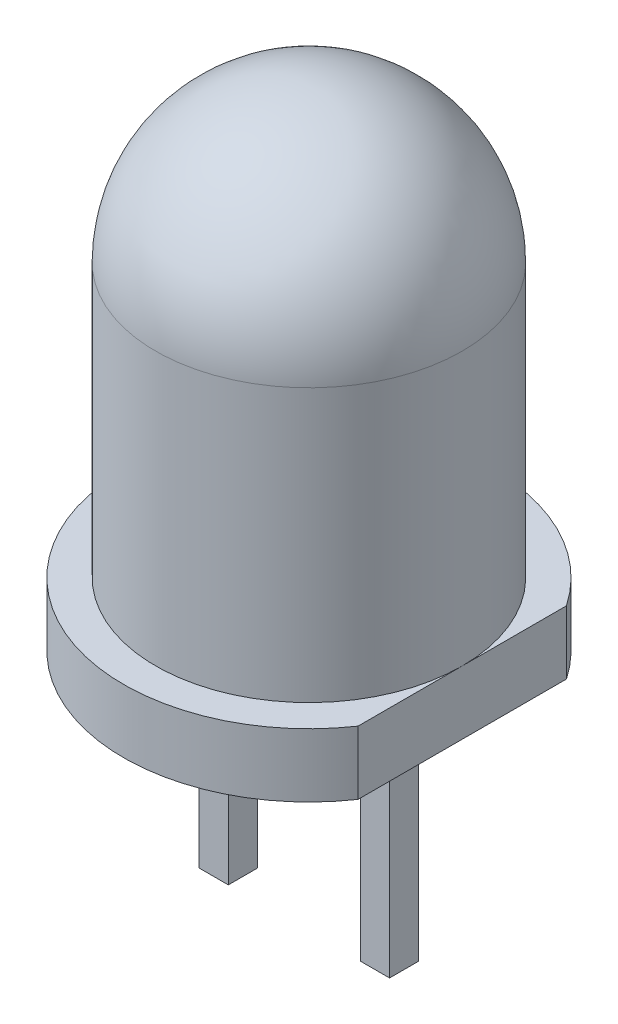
SolidWorks part; units mm, degrees
ref_plane "Front" through (0, 0, 0) normal (0, 0, 1) x (1, 0, 0)
ref_plane "Top" through (0, 0, 0) normal (0, 1, 0) x (1, 0, 0)
ref_plane "Right" through (0, 0, 0) normal (1, 0, 0) x (0, 0, -1)
sketch "Эскиз1" plane through (0, 0, 0) normal (0, 0, 1) x (1, 0, 0)
  line L0 (0, 1) -> (2.92, 1)
  line L1 (2.92, 1) -> (2.92, 2)
  line L2 (2.92, 2) -> (2.415, 2)
  line L3 (2.415, 2) -> (2.415, 6.295)
  line L4 (0, 8.71) -> (0, 1) construction
  line L5 (0, 1) -> (0, 8.71)
  arc A0 (2.415, 6.295) -> (0, 8.71) centre (0, 6.295) ccw
  dimension "D1" = 1
  dimension "D2" = 4.83
  dimension "D3" = 5.84
  dimension "D4" = 7.71
  dimension "D5" = 1
revolve "Повернуть1" add sketch "Эскиз1" angle 360 about L4
sketch "Эскиз2" plane through (0, 1, 0) normal (0, -1, 0) x (1, 0, 0)
  line L0 (0, 0) -> (0, 1.1797) construction
  line L1 (-1.5, 0.23) -> (-1.04, 0.23)
  line L2 (-1.5, 0.23) -> (-1.5, -0.23)
  line L3 (-1.5, -0.23) -> (-1.04, -0.23)
  line L4 (-1.04, 0.23) -> (-1.04, -0.23)
  line L5 (1.04, 0.23) -> (1.04, -0.23)
  line L6 (1.5, -0.23) -> (1.04, -0.23)
  line L7 (1.5, 0.23) -> (1.5, -0.23)
  line L8 (1.5, 0.23) -> (1.04, 0.23)
  line L9 (-1.04, 0) -> (1.04, 0) construction
  dimension "D1" = 2.54
  dimension "D2" = 0.46
extrude "Вытянуть1" add sketch "Эскиз2" along normal blind 3.6
sketch "Эскиз3" plane through (0, 0, 0) normal (0, 1, 0) x (1, 0, 0)
  line L0 (2.415, 1.6414) -> (2.415, -1.6414)
  circle A0 centre (0, 0) radius 2.415 construction
  circle A1 centre (0, 0) radius 2.92 construction
  arc A2 (2.415, -1.6414) -> (2.415, 1.6414) centre (0, 0) ccw
extrude "Вытянуть2" cut sketch "Эскиз3" along normal up to surface (2 mm away)
fillet "Скругление1" radius 0.8 8 edges at (1.27, 1, 0.23) (1.5, 1, 0) (1.27, 1, -0.23) (1.04, 1, 0) (-1.27, 1, -0.23) (-1.5, 1, 0) (-1.27, 1, 0.23) (-1.04, 1, 0)
